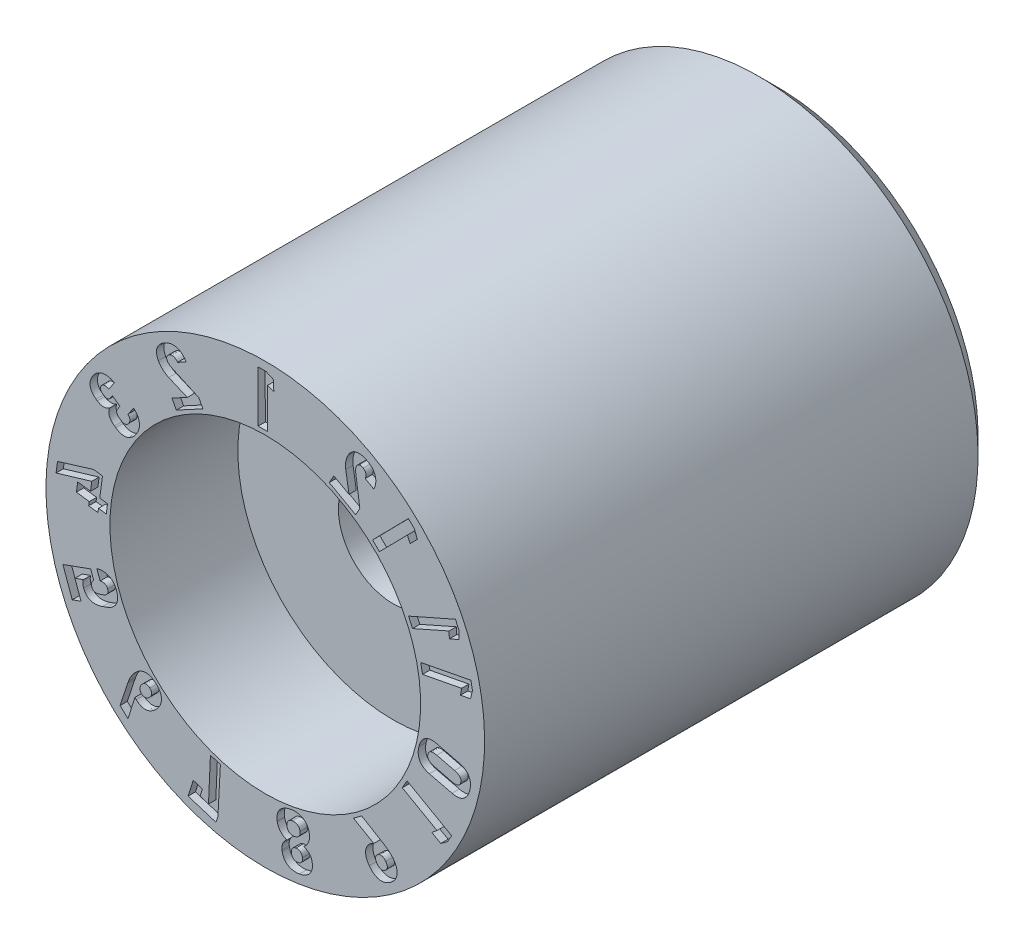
SolidWorks part; units mm, degrees
ref_plane "Front Plane" through (0, 0, 0) normal (0, 0, 1) x (1, 0, 0)
ref_plane "Top Plane" through (0, 0, 0) normal (0, 1, 0) x (1, 0, 0)
ref_plane "Right Plane" through (0, 0, 0) normal (1, 0, 0) x (0, 0, -1)
sketch "Sketch1" plane through (0, 0, 0) normal (1, 0, 0) x (0, 0, -1)
  line L0 (0, 0) -> (9.6542, 0) construction
  line L2 (14, 1.5) -> (14, 5.5)
  line L4 (13.5, 6) -> (0, 6)
  line L5 (0, 6) -> (0, 4.25)
  line L7 (0, 4.25) -> (3.5, 4.25)
  line L8 (3.5, 4.25) -> (3.5, 1.5)
  line L9 (3.5, 1.5) -> (14, 1.5)
  line L12 (14, 5.5) -> (13.5, 6)
  point P6 (14, 6)
  dimension "D1" = 14
  dimension "D2" = 12
  dimension "D3" = 8.5
  dimension "D4" = 3.5
  dimension "D5" = 3
revolve "Revolve1" add sketch "Sketch1" angle 360 about L0
sketch "Sketch2" plane through (0, 0, 0) normal (0, 0, 1) x (1, 0, 0)
  line L0 (-0.1978, 4.3616) -> (0.0666, 4.3632)
  line L1 (0.0666, 4.3632) -> (0.0607, 5.4564)
  line L2 (0.0607, 5.4564) -> (0.2322, 5.3923)
  line L3 (0.2322, 5.3923) -> (0.2307, 5.6736)
  line L4 (0.2307, 5.6736) -> (0.0206, 5.7669)
  line L5 (0.0206, 5.7669) -> (-0.2052, 5.7656)
  line L6 (-0.2052, 5.7656) -> (-0.1978, 4.3616)
  line L7 (-1.8183, 4.2261) -> (-2.5405, 4.5533)
  line L8 (-2.6815, 4.6706) -> (-2.6825, 4.6723)
  line L9 (-2.4005, 4.7723) -> (-2.4001, 4.7714)
  line L10 (-2.4001, 4.7714) -> (-2.1623, 4.8998)
  line L11 (-2.1623, 4.8998) -> (-2.1627, 4.9007)
  line L12 (-2.9247, 4.5502) -> (-2.9243, 4.5492)
  line L13 (-2.643, 4.2936) -> (-2.1333, 4.0748)
  line L14 (-2.1333, 4.0748) -> (-2.554, 3.8474)
  line L15 (-2.554, 3.8474) -> (-2.4333, 3.6239)
  line L16 (-2.4333, 3.6239) -> (-1.7055, 4.017)
  line L17 (-1.7055, 4.017) -> (-1.8183, 4.2261)
  line L18 (-3.6024, 3.083) -> (-3.7584, 2.8613)
  line L19 (-3.9522, 2.6271) -> (-3.9789, 2.6457)
  line L20 (-4.0412, 2.8455) -> (-3.9734, 2.9421)
  line L21 (-3.9734, 2.9421) -> (-4.1805, 3.0877)
  line L22 (-4.1805, 3.0877) -> (-4.2483, 2.9911)
  line L23 (-4.4264, 2.9882) -> (-4.4456, 3.0019)
  line L24 (-4.281, 3.2016) -> (-4.1257, 3.4228)
  line L25 (-4.6298, 2.7867) -> (-4.5953, 2.7624)
  line L26 (-4.1243, 2.4038) -> (-4.0898, 2.3795)
  line L27 (-4.6938, 1.0856) -> (-5.6844, 0.7836)
  line L28 (-5.6844, 0.7836) -> (-5.7241, 0.488)
  line L29 (-5.7241, 0.488) -> (-4.7466, 0.78)
  line L30 (-4.7466, 0.78) -> (-4.7805, 0.527)
  line L31 (-4.8301, 0.157) -> (-4.5784, 0.1231)
  line L32 (-4.5784, 0.1231) -> (-4.5638, 0.2318)
  line L33 (-4.4535, 1.0534) -> (-4.6938, 1.0856)
  line L34 (-5.1318, 0.5742) -> (-5.1669, 0.3128)
  line L35 (-5.1669, 0.3128) -> (-4.8155, 0.2656)
  line L36 (-4.3502, 0.2031) -> (-4.3152, 0.4645)
  line L37 (-4.3152, 0.4645) -> (-4.5287, 0.4932)
  line L38 (-4.6071, -1.2176) -> (-4.6079, -1.2179)
  line L39 (-4.6079, -1.2179) -> (-4.5183, -1.4672)
  line L40 (-4.5183, -1.4672) -> (-4.5174, -1.4668)
  line L41 (-4.4271, -1.7492) -> (-4.538, -1.7891)
  line L42 (-4.6929, -1.5442) -> (-4.7767, -1.3115)
  line L43 (-4.7767, -1.3115) -> (-5.5365, -1.585)
  line L44 (-5.5365, -1.585) -> (-5.2809, -2.2949)
  line L45 (-5.2809, -2.2949) -> (-5.0409, -2.2084)
  line L46 (-5.0409, -2.2084) -> (-5.2069, -1.7477)
  line L47 (-5.2069, -1.7477) -> (-4.9734, -1.6636)
  line L48 (-4.4483, -2.0384) -> (-4.3374, -1.9984)
  line L49 (-3.5682, -3.1669) -> (-3.5687, -3.1675)
  line L50 (-3.7645, -3.5148) -> (-3.9732, -4.1458)
  line L51 (-3.9732, -4.1458) -> (-3.7569, -4.3508)
  line L52 (-3.7569, -4.3508) -> (-3.5638, -3.7468)
  line L54 (-2.979, -3.7333) -> (-2.9785, -3.7327)
  line L55 (-3.158, -3.5396) -> (-3.1588, -3.5405)
  line L56 (-3.3689, -3.3394) -> (-3.3684, -3.3388)
  line L57 (-1.2952, -5.4331) -> (-1.2278, -4.1706)
  line L58 (-1.2278, -4.1706) -> (-1.5007, -4.0851)
  line L59 (-1.5007, -4.0851) -> (-1.5536, -5.2693)
  line L60 (-1.5536, -5.2693) -> (-1.783, -5.1971)
  line L61 (-1.783, -5.1971) -> (-1.72, -4.9958)
  line L62 (-1.72, -4.9958) -> (-1.9718, -4.917)
  line L63 (-1.9718, -4.917) -> (-2.111, -5.3609)
  line L64 (-2.111, -5.3609) -> (-1.3477, -5.6003)
  line L65 (-1.3477, -5.6003) -> (-1.2952, -5.4331)
  line L66 (0.3251, -4.7254) -> (0.3289, -4.7482)
  line L67 (0.457, -5.3502) -> (0.4629, -5.3865)
  line L68 (1.2851, -5.2516) -> (1.2792, -5.2154)
  line L69 (1.2081, -4.6038) -> (1.2043, -4.581)
  line L70 (0.9492, -4.6618) -> (0.9516, -4.6752)
  line L71 (0.5947, -4.733) -> (0.5924, -4.7188)
  line L72 (1.0162, -5.2477) -> (1.0183, -5.2611)
  line L73 (0.7186, -5.3091) -> (0.7162, -5.2948)
  line L75 (2.8434, -4.5302) -> (2.8441, -4.531)
  line L76 (3.5021, -4.0395) -> (3.5017, -4.0391)
  line L77 (3.1959, -3.7908) -> (2.637, -3.4559)
  line L78 (2.637, -3.4559) -> (2.412, -3.622)
  line L79 (2.412, -3.622) -> (2.9688, -3.9429)
  line L80 (3.2964, -4.2058) -> (3.297, -4.2069)
  line L81 (3.061, -4.3795) -> (3.0604, -4.3787)
  line L82 (3.8791, -2.0036) -> (3.7488, -2.2328)
  line L83 (3.7488, -2.2328) -> (4.6977, -2.7714)
  line L84 (4.6977, -2.7714) -> (4.5573, -2.888)
  line L85 (4.5573, -2.888) -> (4.8014, -3.0264)
  line L86 (4.8014, -3.0264) -> (4.9868, -2.8912)
  line L87 (4.9868, -2.8912) -> (5.0981, -2.6952)
  line L88 (5.0981, -2.6952) -> (3.8791, -2.0036)
  line L89 (4.4892, -1.5312) -> (5.1078, -1.6828)
  line L90 (5.3076, -0.8689) -> (4.6889, -0.7172)
  line L91 (4.6916, -0.9897) -> (5.1791, -1.1092)
  line L92 (5.1052, -1.4103) -> (4.6177, -1.2909)
  line L93 (4.2522, 0.9883) -> (4.302, 0.7293)
  line L94 (4.302, 0.7293) -> (5.3716, 0.9348)
  line L95 (5.3716, 0.9348) -> (5.3404, 0.7554)
  line L96 (5.3404, 0.7554) -> (5.6152, 0.8084)
  line L97 (5.6152, 0.8084) -> (5.6683, 1.0311)
  line L98 (5.6683, 1.0311) -> (5.6258, 1.2522)
  line L99 (5.6258, 1.2522) -> (4.2522, 0.9883)
  line L100 (3.9208, 1.9201) -> (4.0278, 1.6782)
  line L101 (4.0278, 1.6782) -> (5.0264, 2.1199)
  line L102 (5.0264, 2.1199) -> (5.0364, 1.9378)
  line L103 (5.0364, 1.9378) -> (5.2931, 2.0512)
  line L104 (5.2931, 2.0512) -> (5.295, 2.2808)
  line L105 (5.295, 2.2808) -> (5.2037, 2.4872)
  line L106 (5.2037, 2.4872) -> (3.9208, 1.9201)
  line L107 (2.9353, 3.2325) -> (3.1233, 3.0474)
  line L108 (3.1233, 3.0474) -> (3.8876, 3.8238)
  line L109 (3.8876, 3.8238) -> (3.9639, 3.6584)
  line L110 (3.9639, 3.6584) -> (4.1603, 3.858)
  line L111 (4.1603, 3.858) -> (4.0774, 4.0721)
  line L112 (4.0774, 4.0721) -> (3.917, 4.23)
  line L113 (3.917, 4.23) -> (2.9353, 3.2325)
  line L114 (2.5868, 3.8042) -> (2.4755, 4.5868)
  line L115 (2.4987, 4.7685) -> (2.4996, 4.7697)
  line L116 (2.734, 4.5859) -> (2.7336, 4.585)
  line L117 (2.7336, 4.585) -> (2.9692, 4.4536)
  line L118 (2.9692, 4.4536) -> (2.9696, 4.4545)
  line L119 (2.2672, 4.9085) -> (2.2668, 4.9075)
  line L120 (2.2021, 4.5337) -> (2.2905, 3.9883)
  line L121 (2.2905, 3.9883) -> (1.8741, 4.2206)
  line L122 (1.8741, 4.2206) -> (1.7506, 3.9993)
  line L123 (1.7506, 3.9993) -> (2.4712, 3.5972)
  line L124 (2.4712, 3.5972) -> (2.5868, 3.8042)
  line L125 (-4.8155, 0.2656) -> (-4.8301, 0.157)
  line L126 (-4.7805, 0.527) -> (-5.1318, 0.5742)
  line L127 (-4.5638, 0.2318) -> (-4.3502, 0.2031)
  line L128 (-4.5287, 0.4932) -> (-4.4535, 1.0534)
  circle A0 centre (0, 0) radius 4.375 construction
  spline S0 degree 3 poles (-2.5405, 4.5533) (-2.5708, 4.5672) (-2.6075, 4.5879) (-2.6434, 4.6209) (-2.6631, 4.6416) (-2.6751, 4.6588) (-2.6815, 4.6706) knots 0 0 0 0 0.540031 0.665532 0.783527 1 1 1 1
  spline S1 degree 3 poles (-2.6825, 4.6723) (-2.691, 4.6872) (-2.6992, 4.7113) (-2.6988, 4.7442) (-2.6926, 4.7672) (-2.6809, 4.789) (-2.657, 4.8174) (-2.6325, 4.8334) (-2.6149, 4.843) knots 0 0 0 0 0.246786 0.35691 0.469448 0.586307 0.710254 1 1 1 1
  spline S2 degree 3 poles (-2.6149, 4.843) (-2.5973, 4.8524) (-2.5688, 4.8625) (-2.5294, 4.8627) (-2.5009, 4.8563) (-2.4734, 4.8439) (-2.4367, 4.8186) (-2.4141, 4.7919) (-2.4005, 4.7723) knots 0 0 0 0 0.240301 0.353786 0.468513 0.587497 0.712892 1 1 1 1
  spline S3 degree 3 poles (-2.1627, 4.9007) (-2.1846, 4.9354) (-2.2212, 4.9835) (-2.2789, 5.0369) (-2.3239, 5.0689) (-2.3711, 5.0942) (-2.4201, 5.1126) (-2.4708, 5.1229) (-2.5228, 5.1266) (-2.5756, 5.1229) (-2.648, 5.1073) (-2.7004, 5.0859) (-2.734, 5.0675) knots 0 0 0 0 0.185247 0.270908 0.353799 0.433963 0.511943 0.589015 0.666847 0.746166 0.827199 1 1 1 1
  spline S4 degree 3 poles (-2.734, 5.0675) (-2.7696, 5.0481) (-2.8196, 5.016) (-2.8765, 4.9646) (-2.9108, 4.9247) (-2.9382, 4.8828) (-2.9584, 4.839) (-2.9717, 4.7936) (-2.9769, 4.7464) (-2.9753, 4.6981) (-2.9621, 4.6306) (-2.9418, 4.5818) (-2.9247, 4.5502) knots 0 0 0 0 0.194583 0.283015 0.366623 0.445927 0.521986 0.596945 0.671952 0.748458 0.827747 1 1 1 1
  spline S5 degree 3 poles (-2.9243, 4.5492) (-2.9089, 4.5214) (-2.8827, 4.481) (-2.8403, 4.4325) (-2.8057, 4.398) (-2.7682, 4.3665) (-2.715, 4.3295) (-2.6726, 4.3062) (-2.643, 4.2936) knots 0 0 0 0 0.246636 0.37153 0.498651 0.625609 0.751024 1 1 1 1
  spline S6 degree 3 poles (-3.5398, 2.4933) (-3.5166, 2.526) (-3.4869, 2.5773) (-3.46, 2.6499) (-3.447, 2.7034) (-3.4407, 2.7567) (-3.4423, 2.8092) (-3.4506, 2.8606) (-3.4662, 2.9108) (-3.4893, 2.9587) (-3.5308, 3.0203) (-3.5722, 3.0595) (-3.6024, 3.083) knots 0 0 0 0 0.181513 0.26641 0.349352 0.42998 0.508355 0.58625 0.665066 0.745087 0.826278 1 1 1 1
  spline S7 degree 3 poles (-3.7584, 2.8613) (-3.7484, 2.852) (-3.7348, 2.8371) (-3.7206, 2.8151) (-3.7123, 2.7987) (-3.707, 2.7817) (-3.7035, 2.7647) (-3.7026, 2.7476) (-3.7036, 2.7303) (-3.7072, 2.7132) (-3.7154, 2.6901) (-3.7246, 2.6737) (-3.732, 2.6633) knots 0 0 0 0 0.185669 0.27185 0.355025 0.435165 0.512269 0.590352 0.667877 0.746758 0.826658 1 1 1 1
  spline S8 degree 3 poles (-3.732, 2.6633) (-3.7447, 2.645) (-3.7669, 2.6203) (-3.804, 2.5999) (-3.8324, 2.5918) (-3.8621, 2.5903) (-3.9043, 2.5982) (-3.9337, 2.6142) (-3.9522, 2.6271) knots 0 0 0 0 0.265738 0.383017 0.496928 0.612242 0.731703 1 1 1 1
  spline S9 degree 3 poles (-3.9789, 2.6457) (-3.9981, 2.6595) (-4.0248, 2.6812) (-4.0496, 2.7168) (-4.0609, 2.7427) (-4.0664, 2.769) (-4.0639, 2.8053) (-4.0521, 2.8306) (-4.0412, 2.8455) knots 0 0 0 0 0.300575 0.428718 0.545676 0.656478 0.765355 1 1 1 1
  spline S10 degree 3 poles (-4.2483, 2.9911) (-4.2566, 2.9784) (-4.2735, 2.9628) (-4.3014, 2.9512) (-4.3241, 2.9485) (-4.3484, 2.9512) (-4.3843, 2.9616) (-4.4098, 2.9766) (-4.4264, 2.9882) knots 0 0 0 0 0.226778 0.333314 0.445235 0.564595 0.695767 1 1 1 1
  spline S11 degree 3 poles (-4.4456, 3.0019) (-4.4612, 3.0131) (-4.4828, 3.0311) (-4.502, 3.061) (-4.5105, 3.0832) (-4.5134, 3.106) (-4.5102, 3.1377) (-4.4991, 3.1599) (-4.4894, 3.1732) knots 0 0 0 0 0.288125 0.411925 0.528489 0.640573 0.752467 1 1 1 1
  spline S12 degree 3 poles (-4.4894, 3.1732) (-4.4828, 3.1826) (-4.4713, 3.1957) (-4.4524, 3.2084) (-4.4374, 3.2165) (-4.4208, 3.2218) (-4.4035, 3.226) (-4.3849, 3.2267) (-4.3655, 3.2263) (-4.3453, 3.2234) (-4.3165, 3.2166) (-4.2953, 3.208) (-4.281, 3.2016) knots 0 0 0 0 0.150328 0.223515 0.297446 0.371959 0.449583 0.529747 0.613909 0.702218 0.795553 1 1 1 1
  spline S13 degree 3 poles (-4.1257, 3.4228) (-4.1607, 3.4428) (-4.2147, 3.468) (-4.2899, 3.4872) (-4.3445, 3.4941) (-4.3979, 3.494) (-4.4497, 3.4876) (-4.4994, 3.4735) (-4.5468, 3.453) (-4.5917, 3.4265) (-4.6477, 3.3827) (-4.6832, 3.3419) (-4.7039, 3.3122) knots 0 0 0 0 0.185403 0.271955 0.355808 0.43751 0.516725 0.595164 0.673981 0.753613 0.833638 1 1 1 1
  spline S14 degree 3 poles (-4.7039, 3.3122) (-4.7205, 3.2882) (-4.7432, 3.2519) (-4.7664, 3.2015) (-4.7794, 3.1651) (-4.7883, 3.129) (-4.7936, 3.0934) (-4.7947, 3.0582) (-4.7916, 3.0237) (-4.785, 2.9899) (-4.7744, 2.9571) (-4.7599, 2.9255) (-4.7417, 2.895) (-4.7191, 2.8661) (-4.6836, 2.8277) (-4.6521, 2.8026) (-4.6298, 2.7867) knots 0 0 0 0 0.145221 0.212039 0.275498 0.336822 0.396212 0.454116 0.511301 0.568162 0.624888 0.681779 0.740523 0.801036 0.863692 1 1 1 1
  spline S15 degree 3 poles (-4.5953, 2.7624) (-4.5703, 2.7451) (-4.5303, 2.723) (-4.4725, 2.7087) (-4.4293, 2.7043) (-4.386, 2.7071) (-4.3276, 2.7201) (-4.2868, 2.7408) (-4.2612, 2.7575) knots 0 0 0 0 0.256538 0.378141 0.499462 0.620241 0.742004 1 1 1 1
  spline S16 degree 3 poles (-4.2612, 2.7575) (-4.2678, 2.7423) (-4.2749, 2.7186) (-4.28, 2.6864) (-4.282, 2.6627) (-4.2811, 2.6391) (-4.2777, 2.6157) (-4.2724, 2.5922) (-4.2646, 2.569) (-4.2546, 2.5462) (-4.2422, 2.524) (-4.2281, 2.5022) (-4.2115, 2.4813) (-4.193, 2.4608) (-4.1646, 2.4338) (-4.1408, 2.4156) (-4.1243, 2.4038) knots 0 0 0 0 0.120514 0.178963 0.236486 0.293076 0.350257 0.408016 0.467449 0.527699 0.589262 0.651768 0.715782 0.783012 0.852532 1 1 1 1
  spline S17 degree 3 poles (-4.0898, 2.3795) (-4.0589, 2.3576) (-4.0104, 2.3298) (-3.942, 2.307) (-3.8925, 2.2977) (-3.8435, 2.2958) (-3.7955, 2.3023) (-3.7484, 2.3158) (-3.7027, 2.337) (-3.6586, 2.3657) (-3.6006, 2.415) (-3.5629, 2.4604) (-3.5398, 2.4933) knots 0 0 0 0 0.178207 0.259967 0.338031 0.414007 0.489005 0.564651 0.643104 0.724692 0.8109 1 1 1 1
  spline S18 degree 3 poles (-4.0723, -1.4624) (-4.084, -1.4281) (-4.1085, -1.3804) (-4.1506, -1.3236) (-4.1871, -1.2871) (-4.228, -1.2559) (-4.2729, -1.2309) (-4.3216, -1.2118) (-4.3738, -1.1994) (-4.4292, -1.1936) (-4.5081, -1.1947) (-4.5676, -1.2063) (-4.6071, -1.2176) knots 0 0 0 0 0.165263 0.244175 0.322923 0.400785 0.478837 0.557609 0.639406 0.724106 0.811786 1 1 1 1
  spline S19 degree 3 poles (-4.5174, -1.4668) (-4.4947, -1.4606) (-4.4607, -1.4564) (-4.4169, -1.4607) (-4.3883, -1.4696) (-4.3628, -1.4833) (-4.3341, -1.5092) (-4.3191, -1.5346) (-4.3128, -1.5533) knots 0 0 0 0 0.286425 0.412421 0.532755 0.648554 0.760969 1 1 1 1
  spline S20 degree 3 poles (-4.3128, -1.5533) (-4.3056, -1.5729) (-4.2994, -1.6038) (-4.3063, -1.6439) (-4.3184, -1.6707) (-4.3369, -1.695) (-4.3709, -1.7257) (-4.4042, -1.7403) (-4.4271, -1.7492) knots 0 0 0 0 0.244768 0.357262 0.468879 0.585371 0.710839 1 1 1 1
  spline S21 degree 3 poles (-4.538, -1.7891) (-4.5611, -1.7978) (-4.5956, -1.8064) (-4.6406, -1.8071) (-4.6695, -1.8012) (-4.695, -1.7904) (-4.7243, -1.7675) (-4.7382, -1.7426) (-4.7446, -1.725) knots 0 0 0 0 0.302893 0.431393 0.55004 0.661203 0.768793 1 1 1 1
  spline S22 degree 3 poles (-4.7446, -1.725) (-4.7507, -1.7083) (-4.7566, -1.6825) (-4.7559, -1.648) (-4.7512, -1.6237) (-4.7424, -1.6007) (-4.7252, -1.5719) (-4.7068, -1.5541) (-4.6929, -1.5442) knots 0 0 0 0 0.263348 0.385872 0.507659 0.627206 0.748083 1 1 1 1
  spline S23 degree 3 poles (-4.9734, -1.6636) (-4.9794, -1.677) (-4.9855, -1.699) (-4.989, -1.7303) (-4.9891, -1.7561) (-4.9872, -1.7826) (-4.9823, -1.8172) (-4.9756, -1.8424) (-4.9699, -1.8586) knots 0 0 0 0 0.220311 0.341953 0.473175 0.608808 0.741307 1 1 1 1
  spline S24 degree 3 poles (-4.9699, -1.8586) (-4.9586, -1.8907) (-4.9362, -1.9359) (-4.8949, -1.9869) (-4.8602, -2.0183) (-4.8211, -2.0436) (-4.7778, -2.0622) (-4.7308, -2.0744) (-4.68, -2.0801) (-4.6261, -2.0795) (-4.5473, -2.0695) (-4.4881, -2.0525) (-4.4483, -2.0384) knots 0 0 0 0 0.163572 0.239328 0.313613 0.387363 0.461653 0.538789 0.6198 0.70611 0.797006 1 1 1 1
  spline S25 degree 3 poles (-4.3374, -1.9984) (-4.2974, -1.9845) (-4.2413, -1.9582) (-4.1752, -1.9127) (-4.1345, -1.875) (-4.1006, -1.8339) (-4.0741, -1.7892) (-4.0546, -1.7414) (-4.0429, -1.6903) (-4.0387, -1.6364) (-4.0431, -1.5589) (-4.059, -1.5009) (-4.0723, -1.4624) knots 0 0 0 0 0.18694 0.272023 0.353193 0.431093 0.506534 0.581498 0.658173 0.737159 0.819461 1 1 1 1
  spline S26 degree 3 poles (-2.9815, -3.1418) (-3.0105, -3.1143) (-3.0568, -3.0778) (-3.1244, -3.0425) (-3.1747, -3.0248) (-3.2253, -3.0153) (-3.2761, -3.0134) (-3.3268, -3.0196) (-3.3774, -3.0333) (-3.4271, -3.0554) (-3.4943, -3.0962) (-3.5394, -3.137) (-3.5682, -3.1669) knots 0 0 0 0 0.180127 0.262705 0.342108 0.418644 0.493746 0.569602 0.647518 0.728441 0.81338 1 1 1 1
  spline S27 degree 3 poles (-3.5687, -3.1675) (-3.5868, -3.1864) (-3.6122, -3.2171) (-3.6433, -3.2611) (-3.6902, -3.3347) (-3.7218, -3.4014) (-3.7435, -3.4566) knots 0 0 0 0 0.230619 0.351394 0.476039 1 1 1 1
  spline S28 degree 3 poles (-3.7435, -3.4566) (-3.7473, -3.4663) (-3.7553, -3.4853) (-3.7612, -3.5051) (-3.7645, -3.5148) knots 0 0 0 0 0.50536 1 1 1 1
  spline S29 degree 3 poles (-3.5638, -3.7468) (-3.5539, -3.7607) (-3.5424, -3.7734) (-3.5301, -3.7852) knots 0.758677 0.758677 0.758677 0.758677 1 1 1 1
  spline S30 degree 3 poles (-3.5301, -3.7852) (-3.5041, -3.8101) (-3.4622, -3.8424) (-3.4003, -3.8721) (-3.3541, -3.8862) (-3.3071, -3.8933) (-3.2595, -3.892) (-3.2116, -3.8839) (-3.1639, -3.8679) (-3.1162, -3.8452) (-3.0517, -3.8029) (-3.0068, -3.7634) (-2.979, -3.7333) knots 0 0 0 0 0.171863 0.250291 0.326567 0.401554 0.476517 0.552896 0.632432 0.716094 0.804581 1 1 1 1
  spline S31 degree 3 poles (-2.9785, -3.7327) (-2.9494, -3.7027) (-2.9112, -3.6546) (-2.8733, -3.5849) (-2.8537, -3.5335) (-2.8417, -3.4821) (-2.8379, -3.4307) (-2.8422, -3.3797) (-2.8547, -3.3295) (-2.8748, -3.2801) (-2.9133, -3.214) (-2.9522, -3.1695) (-2.9815, -3.1418) knots 0 0 0 0 0.186979 0.272364 0.353583 0.431717 0.507486 0.58272 0.659285 0.738013 0.820087 1 1 1 1
  spline S32 degree 3 poles (-3.1562, -3.3258) (-3.1409, -3.3402) (-3.1211, -3.3642) (-3.1075, -3.4018) (-3.1048, -3.4298) (-3.1083, -3.458) (-3.1224, -3.4974) (-3.1427, -3.5233) (-3.158, -3.5396) knots 0 0 0 0 0.260004 0.375028 0.487763 0.603253 0.723686 1 1 1 1
  spline S33 degree 3 poles (-3.1588, -3.5405) (-3.1766, -3.5588) (-3.2044, -3.5837) (-3.2468, -3.6043) (-3.2771, -3.6118) (-3.307, -3.6123) (-3.3469, -3.603) (-3.3731, -3.5848) (-3.3884, -3.5703) knots 0 0 0 0 0.294329 0.419072 0.536316 0.647266 0.758044 1 1 1 1
  spline S34 degree 3 poles (-3.3884, -3.5703) (-3.4041, -3.5563) (-3.4223, -3.5307) (-3.434, -3.4915) (-3.4343, -3.4614) (-3.4278, -3.4307) (-3.4094, -3.3872) (-3.3864, -3.3579) (-3.3689, -3.3394) knots 0 0 0 0 0.240144 0.350681 0.462749 0.580659 0.707141 1 1 1 1
  spline S35 degree 3 poles (-3.3684, -3.3388) (-3.353, -3.3226) (-3.328, -3.3016) (-3.2899, -3.285) (-3.262, -3.28) (-3.2342, -3.282) (-3.1961, -3.2928) (-3.1714, -3.3119) (-3.1562, -3.3258) knots 0 0 0 0 0.277582 0.398175 0.512355 0.625221 0.741294 1 1 1 1
  spline S36 degree 3 poles (0.7015, -4.2678) (0.6601, -4.2748) (0.5999, -4.2896) (0.5266, -4.3231) (0.478, -4.3522) (0.4351, -4.3861) (0.3983, -4.4243) (0.3685, -4.4669) (0.345, -4.5132) (0.3285, -4.5628) (0.3164, -4.6339) (0.3191, -4.6889) (0.3251, -4.7254) knots 0 0 0 0 0.188911 0.276657 0.361678 0.443562 0.521838 0.599287 0.676742 0.754956 0.833257 1 1 1 1
  spline S37 degree 3 poles (0.3289, -4.7482) (0.3344, -4.7822) (0.35, -4.8322) (0.3847, -4.8929) (0.4172, -4.9351) (0.4551, -4.9728) (0.5114, -5.0155) (0.56, -5.0372) (0.5935, -5.0475) knots 0 0 0 0 0.245718 0.369513 0.497226 0.624714 0.74972 1 1 1 1
  spline S38 degree 3 poles (0.5935, -5.0475) (0.5692, -5.0649) (0.5355, -5.0952) (0.5007, -5.1439) (0.4795, -5.1831) (0.4643, -5.2243) (0.4517, -5.2799) (0.4526, -5.3226) (0.457, -5.3502) knots 0 0 0 0 0.257022 0.384551 0.512171 0.638121 0.760049 1 1 1 1
  spline S39 degree 3 poles (0.4629, -5.3865) (0.4687, -5.4207) (0.4825, -5.4709) (0.5151, -5.5306) (0.5442, -5.5703) (0.5793, -5.6043) (0.6185, -5.6339) (0.6627, -5.657) (0.7107, -5.675) (0.7625, -5.6868) (0.8374, -5.6939) (0.8951, -5.6899) (0.9338, -5.6834) knots 0 0 0 0 0.166755 0.246297 0.324383 0.402008 0.479602 0.558559 0.640169 0.724632 0.812105 1 1 1 1
  spline S40 degree 3 poles (0.9338, -5.6834) (0.9724, -5.6767) (1.0287, -5.663) (1.0972, -5.6317) (1.1425, -5.6039) (1.1822, -5.5714) (1.2168, -5.5356) (1.2446, -5.4952) (1.2666, -5.4516) (1.2818, -5.4048) (1.2937, -5.3379) (1.2908, -5.286) (1.2851, -5.2516) knots 0 0 0 0 0.187909 0.275417 0.360083 0.441841 0.520725 0.597915 0.675567 0.754033 0.832948 1 1 1 1
  spline S41 degree 3 poles (1.2792, -5.2154) (1.2747, -5.1873) (1.2614, -5.1462) (1.2313, -5.097) (1.2029, -5.0632) (1.1703, -5.0328) (1.1212, -4.9983) (1.0795, -4.9806) (1.0505, -4.9724) knots 0 0 0 0 0.242453 0.363868 0.489952 0.617354 0.74325 1 1 1 1
  spline S42 degree 3 poles (1.0505, -4.9724) (1.0796, -4.9521) (1.1184, -4.9152) (1.159, -4.8569) (1.1829, -4.809) (1.201, -4.7589) (1.2147, -4.6903) (1.2139, -4.6379) (1.2081, -4.6038) knots 0 0 0 0 0.252158 0.376884 0.504108 0.631296 0.754622 1 1 1 1
  spline S43 degree 3 poles (1.2043, -4.581) (1.1981, -4.5446) (1.1837, -4.4913) (1.149, -4.4282) (1.1179, -4.3864) (1.081, -4.3499) (1.0388, -4.3193) (0.9917, -4.2947) (0.9401, -4.2763) (0.8847, -4.2639) (0.8045, -4.2564) (0.7428, -4.2608) (0.7015, -4.2678) knots 0 0 0 0 0.166471 0.245115 0.32305 0.400163 0.477805 0.556488 0.638411 0.723458 0.81117 1 1 1 1
  spline S44 degree 3 poles (0.7429, -4.5197) (0.7595, -4.5167) (0.7844, -4.5152) (0.8167, -4.5195) (0.8393, -4.5255) (0.8604, -4.5342) (0.8799, -4.5452) (0.8972, -4.5595) (0.9126, -4.5758) (0.9259, -4.5944) (0.9402, -4.6225) (0.9464, -4.6459) (0.9492, -4.6618) knots 0 0 0 0 0.179082 0.263836 0.346473 0.426937 0.506638 0.584521 0.664787 0.745258 0.82724 1 1 1 1
  spline S45 degree 3 poles (0.9516, -4.6752) (0.9541, -4.69) (0.955, -4.7124) (0.95, -4.7413) (0.9432, -4.7615) (0.9333, -4.7801) (0.9214, -4.7976) (0.9064, -4.8132) (0.8892, -4.8271) (0.8697, -4.8391) (0.8399, -4.8522) (0.8158, -4.8586) (0.799, -4.8611) knots 0 0 0 0 0.166565 0.24586 0.324124 0.401703 0.479332 0.558127 0.640221 0.724653 0.811552 1 1 1 1
  spline S46 degree 3 poles (0.799, -4.8611) (0.7822, -4.8637) (0.7572, -4.8662) (0.7248, -4.8628) (0.7024, -4.8579) (0.6815, -4.8501) (0.6626, -4.8397) (0.6452, -4.8275) (0.6303, -4.8123) (0.6173, -4.7954) (0.6032, -4.7695) (0.5973, -4.7479) (0.5947, -4.733) knots 0 0 0 0 0.188247 0.274867 0.359836 0.441322 0.52022 0.597868 0.675487 0.754323 0.833355 1 1 1 1
  spline S47 degree 3 poles (0.5924, -4.7188) (0.5897, -4.7028) (0.5885, -4.6788) (0.593, -4.6477) (0.5998, -4.626) (0.6092, -4.6057) (0.621, -4.5869) (0.6361, -4.5705) (0.6532, -4.5555) (0.673, -4.5431) (0.7021, -4.5285) (0.7264, -4.5225) (0.7429, -4.5197) knots 0 0 0 0 0.17278 0.255069 0.335188 0.415003 0.493111 0.57141 0.652579 0.735418 0.820528 1 1 1 1
  spline S48 degree 3 poles (0.8404, -5.1148) (0.8546, -5.1129) (0.8759, -5.1109) (0.9034, -5.1155) (0.9226, -5.121) (0.9404, -5.1292) (0.9568, -5.1398) (0.9715, -5.1528) (0.9844, -5.1681) (0.9957, -5.1854) (1.0081, -5.2115) (1.0138, -5.2329) (1.0162, -5.2477) knots 0 0 0 0 0.173583 0.255392 0.335492 0.414428 0.492216 0.570546 0.651075 0.734215 0.818823 1 1 1 1
  spline S49 degree 3 poles (1.0183, -5.2611) (1.0206, -5.2749) (1.0218, -5.2955) (1.0179, -5.3222) (1.0128, -5.3409) (1.0051, -5.3582) (0.9952, -5.3741) (0.9828, -5.3883) (0.9684, -5.4009) (0.9522, -5.412) (0.927, -5.4233) (0.9069, -5.4296) (0.8926, -5.4314) knots 0 0 0 0 0.175701 0.257572 0.338547 0.418149 0.495516 0.57329 0.653732 0.735586 0.819888 1 1 1 1
  spline S50 degree 3 poles (0.8926, -5.4314) (0.8785, -5.4332) (0.8573, -5.4354) (0.83, -5.4315) (0.8108, -5.427) (0.793, -5.4198) (0.7768, -5.4098) (0.7622, -5.3978) (0.7492, -5.3837) (0.7384, -5.3674) (0.7266, -5.3429) (0.7208, -5.323) (0.7186, -5.3091) knots 0 0 0 0 0.179176 0.262722 0.344582 0.424728 0.502426 0.581003 0.660377 0.741777 0.824574 1 1 1 1
  spline S51 degree 3 poles (0.7162, -5.2948) (0.7138, -5.2804) (0.7127, -5.2587) (0.7156, -5.2305) (0.721, -5.2108) (0.7284, -5.1924) (0.7385, -5.1756) (0.7504, -5.1603) (0.7649, -5.147) (0.7812, -5.1355) (0.8058, -5.1226) (0.8264, -5.1173) (0.8404, -5.1148) knots 0 0 0 0 0.178389 0.262964 0.344996 0.426393 0.504519 0.583339 0.662244 0.743344 0.825531 1 1 1 1
  spline S52 degree 3 poles (2.9688, -3.9429) (2.9676, -3.9433) (2.9574, -3.9469) (2.9285, -3.9597) (2.9028, -3.9758) (2.886, -3.9882) knots 0.564366 0.564366 0.564366 0.564366 0.581965 0.713241 1 1 1 1
  spline S53 degree 3 poles (2.886, -3.9882) (2.8589, -4.0081) (2.8222, -4.0422) (2.7852, -4.0965) (2.7649, -4.1397) (2.7509, -4.1852) (2.7436, -4.2325) (2.7436, -4.2813) (2.75, -4.3313) (2.7635, -4.3818) (2.7907, -4.4507) (2.8205, -4.4992) (2.8434, -4.5302) knots 0 0 0 0 0.165213 0.243295 0.321098 0.398558 0.4759 0.554875 0.637363 0.722439 0.810763 1 1 1 1
  spline S54 degree 3 poles (2.8441, -4.531) (2.8693, -4.5648) (2.9098, -4.6118) (2.9724, -4.6617) (3.0197, -4.6906) (3.0686, -4.7115) (3.1188, -4.7242) (3.17, -4.7292) (3.222, -4.7256) (3.2744, -4.7144) (3.3464, -4.6875) (3.3973, -4.657) (3.4298, -4.6327) knots 0 0 0 0 0.187453 0.273103 0.354468 0.432526 0.508157 0.58355 0.659808 0.738585 0.820198 1 1 1 1
  spline S55 degree 3 poles (3.4298, -4.6327) (3.4622, -4.6088) (3.5065, -4.5694) (3.553, -4.5083) (3.5789, -4.4613) (3.5971, -4.4122) (3.6072, -4.3615) (3.6096, -4.3094) (3.6038, -4.2561) (3.59, -4.202) (3.5603, -4.1269) (3.5275, -4.0737) (3.5021, -4.0395) knots 0 0 0 0 0.178257 0.259594 0.33812 0.4147 0.489866 0.565782 0.643898 0.725895 0.811719 1 1 1 1
  spline S56 degree 3 poles (3.5017, -4.0391) (3.4872, -4.0192) (3.4626, -3.9906) (3.4258, -3.9549) (3.3946, -3.928) (3.3609, -3.9013) (3.3113, -3.8645) (3.2716, -3.8384) (3.2446, -3.8207) knots 0 0 0 0 0.216947 0.333216 0.45375 0.5803 0.714146 1 1 1 1
  spline S57 degree 3 poles (3.2446, -3.8207) (3.2366, -3.8154) (3.2204, -3.8054) (3.2044, -3.795) (3.1959, -3.7908) knots 0 0 0 0 0.502406 1 1 1 1
  spline S58 degree 3 poles (3.0768, -4.1542) (3.0934, -4.1414) (3.1213, -4.1271) (3.1616, -4.122) (3.1909, -4.1258) (3.2196, -4.1357) (3.2578, -4.1602) (3.2821, -4.1859) (3.2964, -4.2058) knots 0 0 0 0 0.246067 0.358457 0.471835 0.589083 0.712499 1 1 1 1
  spline S59 degree 3 poles (3.297, -4.2069) (3.3113, -4.2257) (3.3281, -4.2556) (3.3392, -4.298) (3.3398, -4.3275) (3.334, -4.3558) (3.3162, -4.3918) (3.2944, -4.4141) (3.2774, -4.4262) knots 0 0 0 0 0.283319 0.405631 0.522186 0.634485 0.748744 1 1 1 1
  spline S60 degree 3 poles (3.2774, -4.4262) (3.2604, -4.4385) (3.2329, -4.4541) (3.1927, -4.4595) (3.1639, -4.4568) (3.1359, -4.4471) (3.0984, -4.424) (3.0747, -4.3988) (3.061, -4.3795) knots 0 0 0 0 0.252249 0.365948 0.478304 0.594067 0.716781 1 1 1 1
  spline S61 degree 3 poles (3.0604, -4.3787) (3.046, -4.359) (3.0274, -4.3286) (3.0163, -4.2848) (3.0151, -4.2546) (3.0204, -4.2258) (3.0374, -4.1888) (3.0599, -4.1667) (3.0768, -4.1542) knots 0 0 0 0 0.287505 0.411242 0.527096 0.639457 0.752084 1 1 1 1
  spline S62 degree 3 poles (4.2025, -1.0293) (4.1947, -1.0606) (4.1866, -1.1071) (4.1828, -1.1682) (4.1845, -1.2105) (4.1899, -1.2507) (4.1992, -1.2887) (4.2129, -1.3244) (4.2302, -1.3579) (4.251, -1.389) (4.2752, -1.4176) (4.3029, -1.4431) (4.3337, -1.4662) (4.3677, -1.4868) (4.4189, -1.511) (4.4605, -1.524) (4.4892, -1.5312) knots 0 0 0 0 0.147114 0.214655 0.278552 0.340153 0.39914 0.456578 0.513845 0.570705 0.626912 0.684037 0.742067 0.802468 0.864949 1 1 1 1
  spline S63 degree 3 poles (5.1078, -1.6828) (5.1368, -1.6898) (5.1799, -1.6974) (5.2368, -1.6996) (5.2767, -1.6976) (5.3149, -1.6913) (5.3513, -1.6811) (5.3859, -1.667) (5.4187, -1.649) (5.4495, -1.6272) (5.4776, -1.6016) (5.5035, -1.5724) (5.5268, -1.5393) (5.5474, -1.5024) (5.5727, -1.4469) (5.5864, -1.4018) (5.594, -1.3706) knots 0 0 0 0 0.135933 0.198749 0.259181 0.317693 0.374727 0.431 0.487859 0.544848 0.602171 0.661143 0.722378 0.786127 0.853397 1 1 1 1
  spline S64 degree 3 poles (5.594, -1.3706) (5.6015, -1.3393) (5.6104, -1.2929) (5.6138, -1.2318) (5.6128, -1.1895) (5.6073, -1.1494) (5.5982, -1.1114) (5.585, -1.0757) (5.5682, -1.0422) (5.5473, -1.0115) (5.5232, -0.9831) (5.4958, -0.957) (5.4644, -0.9344) (5.4304, -0.9134) (5.3784, -0.8896) (5.3366, -0.876) (5.3076, -0.8689) knots 0 0 0 0 0.146813 0.214284 0.278279 0.339211 0.398462 0.455807 0.512307 0.56852 0.624668 0.68185 0.740176 0.800514 0.863812 1 1 1 1
  spline S65 degree 3 poles (4.6889, -0.7172) (4.66, -0.7102) (4.6168, -0.7026) (4.5599, -0.7004) (4.52, -0.7024) (4.4819, -0.7088) (4.4455, -0.7189) (4.4109, -0.7331) (4.3781, -0.7508) (4.3473, -0.7726) (4.3192, -0.7984) (4.2933, -0.8276) (4.27, -0.8608) (4.2494, -0.8976) (4.2241, -0.9531) (4.2104, -0.9982) (4.2025, -1.0293) knots 0 0 0 0 0.135939 0.198758 0.259192 0.317706 0.374742 0.431018 0.487519 0.544511 0.602243 0.661217 0.722455 0.786207 0.853479 1 1 1 1
  spline S66 degree 3 poles (4.4495, -1.0899) (4.4525, -1.0778) (4.4582, -1.0603) (4.4696, -1.0395) (4.4788, -1.0257) (4.4899, -1.0141) (4.5019, -1.0036) (4.5158, -0.9955) (4.5359, -0.9861) (4.5648, -0.9789) (4.6193, -0.9752) (4.6622, -0.9827) (4.6916, -0.9897) knots 0 0 0 0 0.125814 0.183206 0.23813 0.291732 0.344481 0.398117 0.45264 0.567735 0.694864 1 1 1 1
  spline S67 degree 3 poles (5.1791, -1.1092) (5.2086, -1.116) (5.2495, -1.1304) (5.2966, -1.1581) (5.3189, -1.178) (5.3325, -1.1956) (5.3409, -1.2093) (5.3466, -1.224) (5.3508, -1.2396) (5.3526, -1.256) (5.3534, -1.2798) (5.3497, -1.2979) (5.347, -1.31) knots 0 0 0 0 0.30454 0.432044 0.547816 0.602595 0.65542 0.70833 0.761154 0.81687 0.874657 1 1 1 1
  spline S68 degree 3 poles (5.347, -1.31) (5.3438, -1.322) (5.3387, -1.3397) (5.3271, -1.3605) (5.318, -1.3743) (5.3069, -1.3859) (5.2948, -1.3963) (5.2813, -1.4048) (5.261, -1.4141) (5.2319, -1.4209) (5.1774, -1.4255) (5.1345, -1.4168) (5.1052, -1.4103) knots 0 0 0 0 0.125854 0.18322 0.23812 0.291697 0.344423 0.397546 0.452045 0.567797 0.695375 1 1 1 1
  spline S69 degree 3 poles (4.6177, -1.2909) (4.5884, -1.2836) (4.547, -1.2702) (4.5003, -1.2419) (4.4781, -1.2221) (4.4645, -1.2045) (4.4561, -1.1908) (4.4501, -1.176) (4.4457, -1.1604) (4.4438, -1.1439) (4.4438, -1.1201) (4.4464, -1.102) (4.4495, -1.0899) knots 0 0 0 0 0.304459 0.431969 0.54676 0.601513 0.654312 0.707926 0.76137 0.817058 0.874364 1 1 1 1
  spline S70 degree 3 poles (2.4755, 4.5868) (2.4703, 4.6199) (2.4689, 4.6617) (2.477, 4.7097) (2.4843, 4.7374) (2.4922, 4.7567) (2.4987, 4.7685) knots 0 0 0 0 0.540472 0.665265 0.783373 1 1 1 1
  spline S71 degree 3 poles (2.4996, 4.7697) (2.5077, 4.7848) (2.5235, 4.8049) (2.5514, 4.8224) (2.5741, 4.8295) (2.5987, 4.831) (2.6353, 4.8266) (2.6617, 4.8137) (2.6793, 4.8047) knots 0 0 0 0 0.247786 0.358949 0.470787 0.5868 0.711755 1 1 1 1
  spline S72 degree 3 poles (2.6793, 4.8047) (2.6969, 4.7951) (2.7204, 4.7762) (2.7421, 4.7433) (2.7515, 4.7158) (2.7561, 4.6859) (2.754, 4.6413) (2.7433, 4.6079) (2.734, 4.5859) knots 0 0 0 0 0.240719 0.353528 0.46771 0.586635 0.713026 1 1 1 1
  spline S73 degree 3 poles (2.9696, 4.4545) (2.987, 4.4917) (3.0084, 4.5484) (3.0222, 4.6258) (3.0251, 4.6808) (3.0209, 4.7339) (3.0103, 4.7849) (2.9918, 4.8331) (2.9671, 4.8786) (2.9357, 4.9211) (2.884, 4.9736) (2.8378, 5.0061) (2.8045, 5.0247) knots 0 0 0 0 0.186124 0.272067 0.354665 0.434533 0.512657 0.589368 0.667373 0.746383 0.827501 1 1 1 1
  spline S74 degree 3 poles (2.8045, 5.0247) (2.7693, 5.0447) (2.7154, 5.0692) (2.6417, 5.0896) (2.5899, 5.0971) (2.54, 5.0977) (2.4923, 5.0916) (2.4471, 5.0777) (2.4043, 5.0575) (2.3646, 5.0301) (2.3147, 4.9832) (2.2848, 4.9396) (2.2672, 4.9085) knots 0 0 0 0 0.19471 0.282993 0.366389 0.445897 0.522009 0.596736 0.672148 0.748568 0.82781 1 1 1 1
  spline S75 degree 3 poles (2.2668, 4.9075) (2.2511, 4.8799) (2.2317, 4.836) (2.2134, 4.7745) (2.2032, 4.7267) (2.1969, 4.6782) (2.1938, 4.6136) (2.1972, 4.5654) (2.2021, 4.5337) knots 0 0 0 0 0.246607 0.371179 0.498175 0.625815 0.751251 1 1 1 1
  dimension "D1" = 8.75
extrude "Cut-Extrude1" cut sketch "Sketch2" against normal blind 0.2
